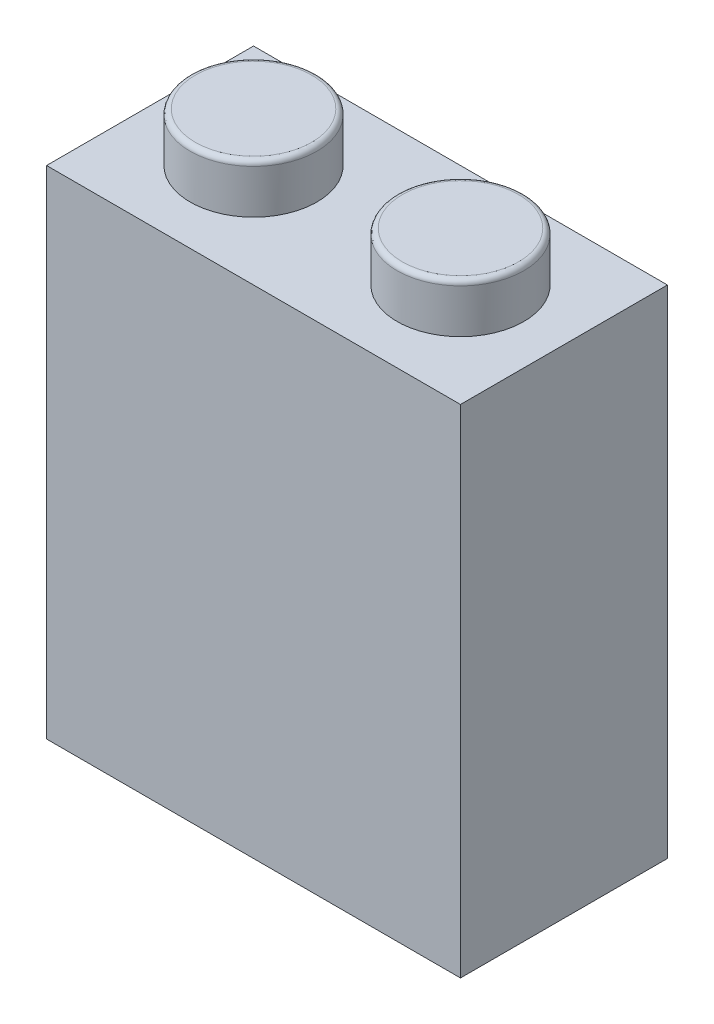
SolidWorks part; units mm, degrees
ref_plane "Vorne" through (0, 0, 0) normal (0, 0, 1) x (1, 0, 0)
ref_plane "Oben" through (0, 0, 0) normal (0, 1, 0) x (1, 0, 0)
ref_plane "Rechts" through (0, 0, 0) normal (1, 0, 0) x (0, 0, -1)
sketch "Skizze2" plane through (0, 0, 0) normal (0, 0, 1) x (1, 0, 0)
  line L1 (0, 0) -> (16, 0)
  line L2 (0, 0) -> (0, 19.2)
  line L3 (0, 19.2) -> (16, 19.2)
  line L4 (16, 0) -> (16, 19.2)
  dimension "D1" = 16
  dimension "D2" = 19.2
extrude "Linear austragen1" add sketch "Skizze2" along normal blind 8
sketch "Skizze3" plane through (0, 19.2, 0) normal (0, 1, 0) x (-1, 0, 0)
  line L0 (-16, 8) -> (-16, 0) construction
  line L1 (0, 8) -> (0, 0) construction
  line L2 (-16, 0) -> (0, 0) construction
  circle A0 centre (-12, 4) radius 2.45
  circle A1 centre (-4, 4) radius 2.45
  dimension "D5" = 4.9
  dimension "D6" = 4.9
  dimension "D1" = 4
  dimension "D2" = 4
  dimension "D3" = 4
  dimension "D4" = 4
extrude "Linear austragen2" add sketch "Skizze3" along normal blind 1.9
fillet "Verrundung1" radius 0.2 2 edges at (12, 21.1, 6.45) (4, 21.1, 6.45)
sketch "Skizze4" plane through (0, 0, 0) normal (0, -1, 0) x (1, 0, 0)
  line L0 (0, 8) -> (16, 8) construction
  line L1 (1.6, 6.4) -> (14.4, 6.4)
  line L2 (1.6, 6.4) -> (1.6, 1.6)
  line L3 (1.6, 1.6) -> (14.4, 1.6)
  line L4 (14.4, 6.4) -> (14.4, 1.6)
  line L5 (0, 0) -> (16, 0) construction
  line L6 (16, 8) -> (16, 0) construction
  line L7 (0, 8) -> (0, 0) construction
  dimension "D1" = 1.6
  dimension "D2" = 1.6
  dimension "D3" = 1.6
  dimension "D4" = 1.6
extrude "Schnitt-Linear austragen1" cut sketch "Skizze4" against normal blind 18.2
sketch "Skizze5" plane through (0, 18.2, 0) normal (0, -1, 0) x (1, 0, 0)
  circle A0 centre (4, 4) radius 1.6
  circle A1 centre (12, 4) radius 1.6
extrude "Schnitt-Linear austragen2" cut sketch "Skizze5" against normal blind 1.8
sketch "Skizze6" plane through (0, 18.2, 0) normal (0, -1, 0) x (1, 0, 0)
  line L0 (7.2, 6.4) -> (7.2, 4.95)
  line L1 (14.4, 6.4) -> (1.6, 6.4) construction
  line L2 (7.2, 4.95) -> (6.7881, 4.95)
  line L3 (6.7881, 4.95) -> (5.7, 6.4)
  line L4 (5.7, 6.4) -> (7.2, 6.4)
  line L5 (8.1, 6.4) -> (8.1, -0.3344) construction
  line L6 (1.6, 4) -> (14.5356, 4) construction
  line L7 (1.6, 6.4) -> (1.6, 1.6) construction
  line L8 (16, 8) -> (16, 0) construction
  line L10 (9, 4.95) -> (9.4119, 4.95)
  line L11 (9, 6.4) -> (9, 4.95)
  line L12 (9.4119, 4.95) -> (10.5, 6.4)
  line L13 (10.5, 6.4) -> (9, 6.4)
  line L14 (7.2, 3.05) -> (6.7881, 3.05)
  line L15 (6.7881, 3.05) -> (5.7, 1.6)
  line L16 (5.7, 1.6) -> (7.2, 1.6)
  line L17 (7.2, 1.6) -> (7.2, 3.05)
  line L18 (9, 3.05) -> (9.4119, 3.05)
  line L19 (9, 1.6) -> (9, 3.05)
  line L20 (10.5, 1.6) -> (9, 1.6)
  line L21 (9.4119, 3.05) -> (10.5, 1.6)
  dimension "D1" = 7.9
  dimension "D2" = 1.8
  dimension "D3" = 1.9
  dimension "D4" = 4.8
extrude "Linear austragen3" add sketch "Skizze6" along normal blind 17.7
chamfer "Fase2" distance 1 angle 50 4 edges at (6.9941, 0.5, 4.95) (9.2059, 0.5, 4.95) (6.9941, 0.5, 3.05) (9.2059, 0.5, 3.05)
